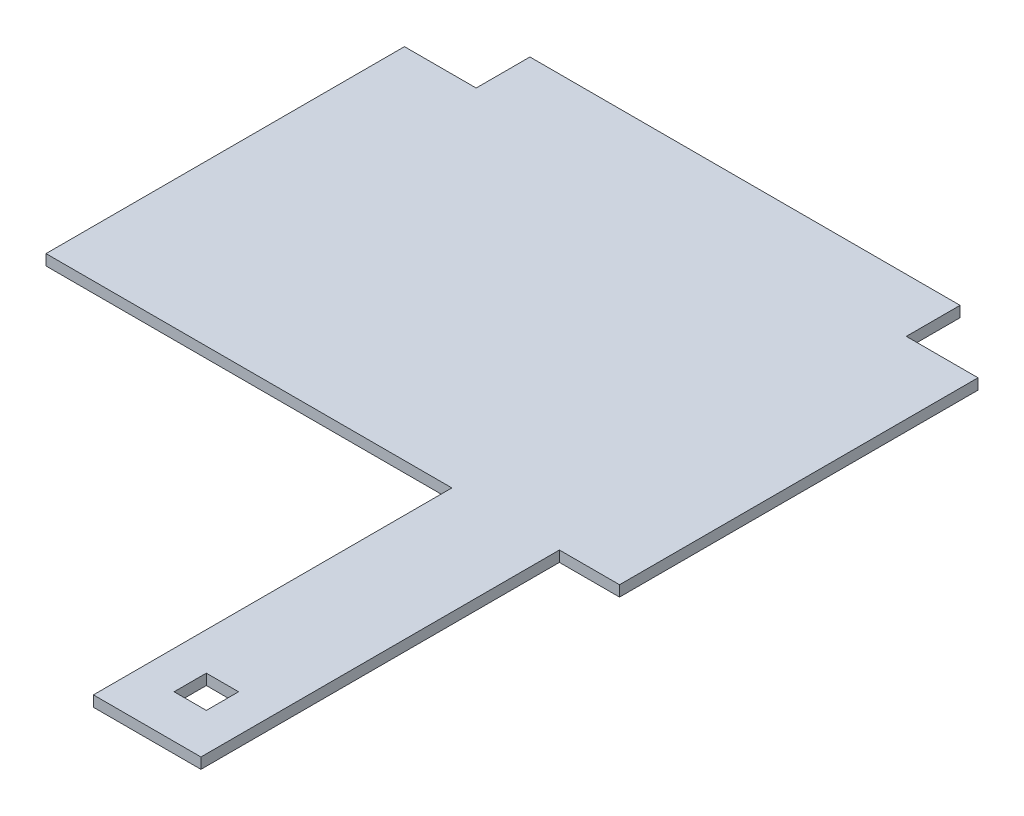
SolidWorks part; units mm, degrees
ref_plane "Front Plane" through (0, 0, 0) normal (0, 0, 1) x (1, 0, 0)
ref_plane "Top Plane" through (0, 0, 0) normal (0, 1, 0) x (1, 0, 0)
ref_plane "Right Plane" through (0, 0, 0) normal (1, 0, 0) x (0, 0, -1)
sketch "Sketch1" plane through (0, 0, 0) normal (0, 1, 0) x (1, 0, 0)
  line L0 (48.226, -150) -> (48.226, -95.6287) construction
  line L1 (-80, 50) -> (-60, 50)
  line L2 (-80, 50) -> (-80, -50)
  line L3 (-80, -50) -> (33.226, -50)
  line L4 (80, 50) -> (80, -50)
  line L5 (-80, 50) -> (80, -50) construction
  line L6 (-80, -50) -> (80, 50) construction
  line L7 (63.226, -50) -> (80, -50)
  line L8 (-60, 50) -> (-60, 65)
  line L9 (-60, 65) -> (60, 65)
  line L10 (60, 50) -> (60, 65)
  line L12 (33.226, -50) -> (33.226, -150)
  line L13 (33.226, -150) -> (63.226, -150)
  line L14 (63.226, -50) -> (63.226, -150)
  line L15 (0, 65) -> (0, 50) construction
  line L16 (0, 50) -> (0, -50) construction
  line L17 (60, 50) -> (80, 50)
  line L18 (43.726, -129) -> (52.726, -129)
  line L19 (43.726, -129) -> (43.726, -138)
  line L20 (43.726, -138) -> (52.726, -138)
  line L21 (52.726, -129) -> (52.726, -138)
  line L22 (43.726, -129) -> (52.726, -138) construction
  line L23 (43.726, -138) -> (52.726, -129) construction
  line L24 (35.726, -121) -> (60.726, -121) construction
  line L25 (35.726, -121) -> (35.726, -146) construction
  line L26 (35.726, -146) -> (60.726, -146) construction
  line L27 (60.726, -121) -> (60.726, -146) construction
  line L28 (35.726, -121) -> (60.726, -146) construction
  line L29 (35.726, -146) -> (60.726, -121) construction
  point P0 (0, 0)
  point P18 (48.226, -133.5)
  point P23 (48.226, -133.5)
  dimension "D1" = 160
  dimension "D2" = 100
  dimension "D3" = 15
  dimension "D4" = 120
  dimension "D5" = 30
  dimension "D6" = 100
  dimension "D7" = 9
  dimension "D8" = 12
  dimension "D9" = 25
  dimension "D10" = 80
extrude "Boss-Extrude1" add sketch "Sketch1" along normal blind 3
